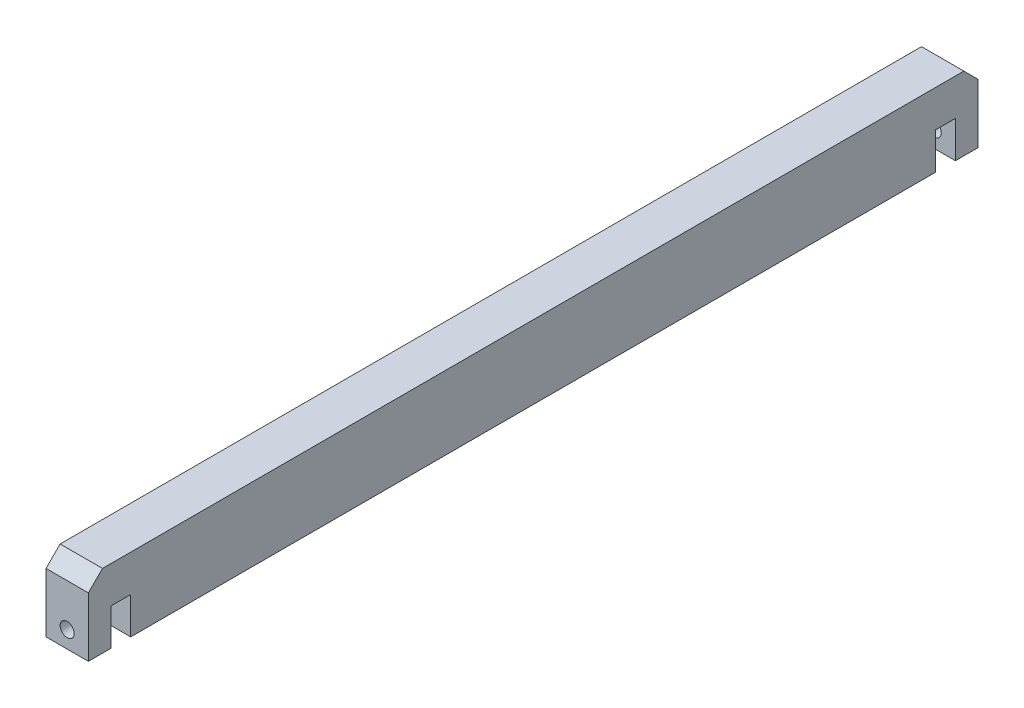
SolidWorks part; units mm, degrees
ref_plane "Plan de face" through (0, 0, 0) normal (0, 0, 1) x (1, 0, 0)
ref_plane "Plan de dessus" through (0, 0, 0) normal (0, 1, 0) x (1, 0, 0)
ref_plane "Plan de droite" through (0, 0, 0) normal (1, 0, 0) x (0, 0, -1)
sketch "Esquisse1" plane through (0, 0, 0) normal (0, 0, 1) x (1, 0, 0)
  line L1 (0, 0) -> (15, 0)
  line L2 (0, 0) -> (0, 26)
  line L3 (0, 26) -> (15, 26)
  line L4 (15, 0) -> (15, 26)
  dimension "D1" = 15
  dimension "D2" = 26
extrude "Boss.-Extru.1" add sketch "Esquisse1" along normal mid plane 315
sketch "Esquisse2" plane through (15, 0, 0) normal (1, 0, 0) x (0, 0, -1)
  line L0 (-157.5, 0) -> (157.5, 0) construction
  line L1 (-149.5, -9.3161) -> (-142.5, -9.3161)
  line L2 (-149.5, -9.3161) -> (-149.5, 13)
  line L3 (-149.5, 13) -> (-142.5, 13)
  line L4 (-142.5, -9.3161) -> (-142.5, 13)
  point P6 (0, 0)
  dimension "D1" = 7
  dimension "D2" = 13
  dimension "D3" = 142.5
extrude "Enlèv. mat.-Extru.1" cut sketch "Esquisse2" against normal through all
hole_wizard "Trou taraudé M61" positions "Esquisse5" profile "Esquisse4" tap size "M6" standard "ISO"
sketch "Esquisse5" plane through (0, 0, 157.5) normal (0, 0, 1) x (1, 0, 0)
  line L0 (15, 0) -> (15, 26) construction
  line L1 (0, 0) -> (15, 0) construction
  point P0 (7.5, 6)
  dimension "D1" = 7.5
  dimension "D2" = 6
sketch "Esquisse4" plane through (7.5, 6, 157.5) normal (1, 0, 0) x (0, -1, 0)
  line L0 (0, 0) -> (0, 300)
  line L1 (0, 300) -> (2.5, 300)
  line L2 (2.5, 300) -> (2.5, 0)
  line L5 (2.5, 0) -> (0, 0)
  line L11 (0, -6.35) -> (0, 107.95) construction
  dimension "Diamètre du trou pour taraudage jusqu'au prochain" = 5
  dimension "Profondeur du trou pour taraudage jusqu'au prochain" = 300
chamfer "Chanfrein1" distance 5 angle 45 2 edges at (7.5, 26, 157.5) (7.5, 26, -157.5)
mirror "Symétrie3" about plane through (0, 0, 0) normal (0, 0, 1) of "Trou taraudé M61", "Enlèv. mat.-Extru.1"
